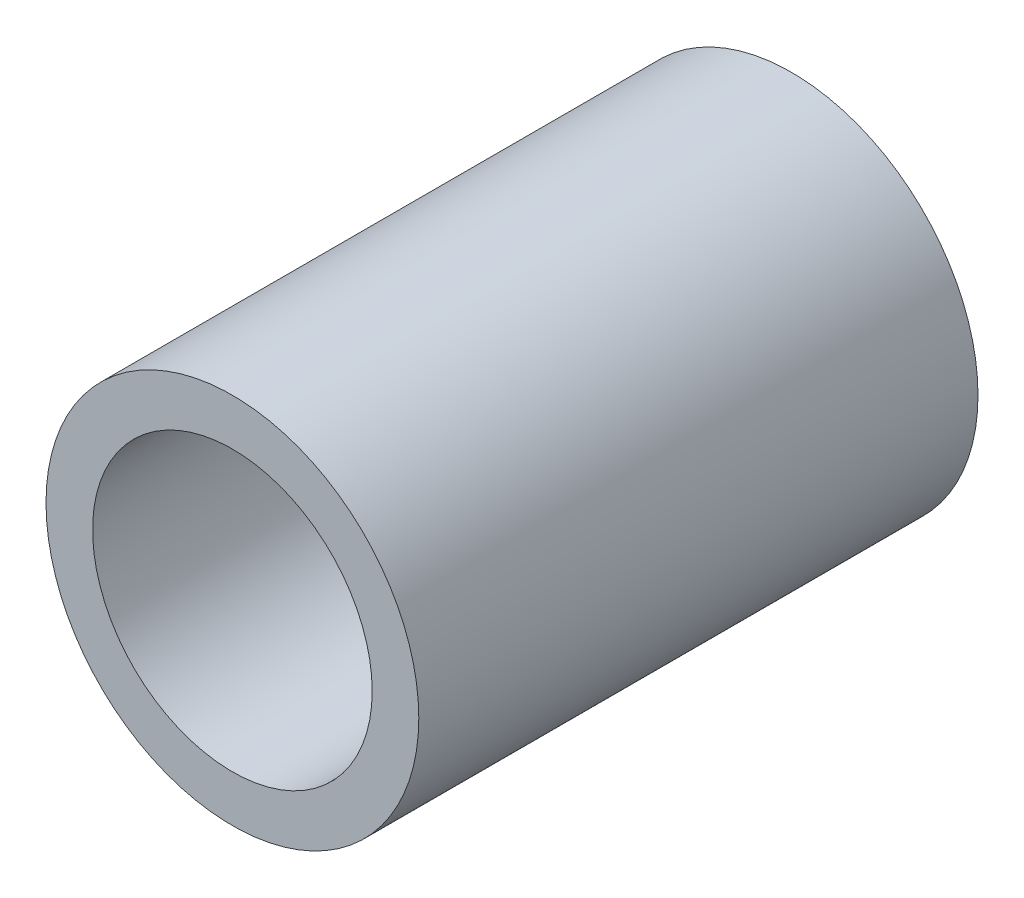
SolidWorks part; units mm, degrees
ref_plane "Plan1" through (0, 0, 0) normal (0, 0, 1) x (1, 0, 0)
ref_plane "Plan2" through (0, 0, 0) normal (0, 1, 0) x (1, 0, 0)
ref_plane "Plan3" through (0, 0, 0) normal (1, 0, 0) x (0, 0, -1)
sketch "Esquisse1" plane through (0, 0, 0) normal (0, 0, 1) x (1, 0, 0)
  circle A0 centre (0, 0) radius 6
  circle A1 centre (0, 0) radius 4.5
  dimension "D1" = 12
  dimension "D2" = 9
extrude "Base-Extrusion" add sketch "Esquisse1" along normal blind 18
